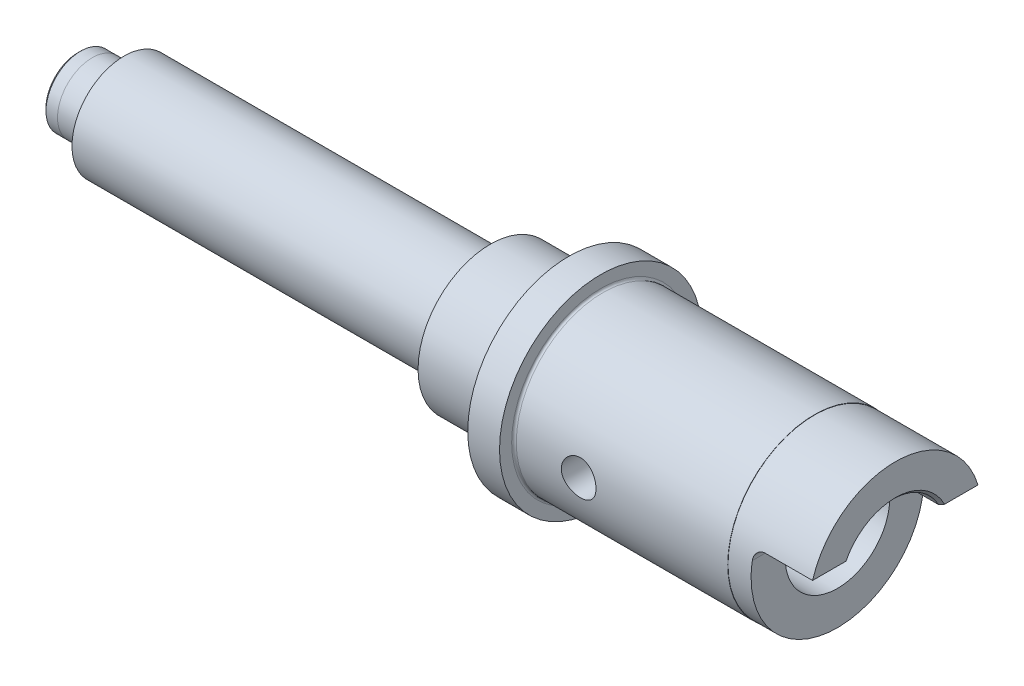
SolidWorks part; units mm, degrees
ref_plane "Face" through (0, 0, 0) normal (0, 0, 1) x (1, 0, 0)
ref_plane "Dessus" through (0, 0, 0) normal (0, 1, 0) x (1, 0, 0)
ref_plane "Droite" through (0, 0, 0) normal (1, 0, 0) x (0, 0, -1)
sketch "Esquisse1" plane through (0, 0, 0) normal (0, 0, 1) x (1, 0, 0)
  line L0 (-32.8532, 0) -> (158.3561, 0) construction
  line L1 (0, 0) -> (0, 5.495)
  line L2 (2.5, 6) -> (8, 6)
  line L3 (8, 6) -> (8, 9)
  line L4 (8, 9) -> (71.4, 9)
  line L5 (71.4, 9) -> (71.4, 12.5)
  line L6 (71.4, 12.5) -> (85, 12.5)
  line L7 (85, 12.5) -> (85, 17.5)
  line L8 (85, 17.5) -> (90.5, 17.5)
  line L9 (90.5, 17.5) -> (90.5, 15)
  line L10 (90.5, 15) -> (127.5, 15)
  line L11 (127.5, 15) -> (127.5, 14.95)
  line L12 (141.5, 0) -> (0, 0)
  line L13 (127.5, 14.95) -> (141.5, 14.95)
  line L14 (141.5, 14.95) -> (141.5, 0)
  line L15 (0, 5.495) -> (0.5, 5.995)
  line L16 (0.5, 5.995) -> (2.5, 6)
  dimension "D1" = 12
  dimension "D3" = 18
  dimension "D4" = 63.4
  dimension "D5" = 25
  dimension "D6" = 35
  dimension "D7" = 5.5
  dimension "D8" = 82.5
  dimension "D9" = 30
  dimension "D10" = 37
  dimension "D11" = 29.9
  dimension "D12" = 14
  dimension "D13" = 11.99
  dimension "D14" = 2
  dimension "D15" = 0.5
  dimension "D16" = 45
revolve "Révolution1" add sketch "Esquisse1" angle 360 about L0
hole_wizard "Diamètre du perçage Ø18.0 (18)1" positions "Esquisse3" profile "Esquisse2" hole size "Ø18.0" standard "ISO"
sketch "Esquisse3" plane through (141.5, 0, 0) normal (1, 0, 0) x (0, 0, -1)
  circle A0 centre (0, 0) radius 14.95 construction
  point P0 (0, 0)
sketch "Esquisse2" plane through (141.5, 0, 0) normal (0, 1, 0) x (0, 0, -1)
  line L0 (0, 0) -> (0, 47.4378)
  line L1 (0, 47.4378) -> (9.05, 42)
  line L2 (9.05, 42) -> (9.05, 0)
  line L5 (9.05, 0) -> (0, 0)
  line L10 (0, 47.4378) -> (-9.05, 42) construction
  line L11 (0, -6.35) -> (0, 107.95) construction
  dimension "Diamètre du perçage" = 18.1
  dimension "Profondeur du perçage" = 42
  dimension "Angle de pointe" = 118
sketch "Esquisse4" plane through (0, 0, 0) normal (0, 0, 1) x (1, 0, 0)
  line L0 (90.5, -15) -> (90.5, 15) construction
  line L1 (131.5, 4.3) -> (146.5, 4.3)
  line L2 (131.5, 4.3) -> (131.5, -25.7)
  line L3 (131.5, -25.7) -> (146.5, -25.7)
  line L4 (146.5, 4.3) -> (146.5, -25.7)
  dimension "D1" = 4.3
  dimension "D2" = 41
  dimension "D3" = 15
  dimension "D4" = 30
extrude "Enlèv. mat.-Extru.1" cut sketch "Esquisse4" against normal through all and the other way through all
sketch "Esquisse5" plane through (0, 0, 0) normal (0, 0, 1) x (1, 0, 0)
  line L0 (90.5, -15) -> (90.5, 15) construction
  circle A0 centre (101.7, 0) radius 3
  dimension "D1" = 6
  dimension "D2" = 11.2
extrude "Enlèv. mat.-Extru.2" cut sketch "Esquisse5" against normal through all and the other way through all
fillet "Congé1" radius 0.8 1 edges at (8, 0, 6)
fillet "Congé2" radius 0.8 1 edges at (71.4, 0, 9)
fillet "Congé3" radius 0.2 1 edges at (85, 0, 12.5)
fillet "Congé4" radius 0.4 1 edges at (90.5, 0, 15)
fillet "Congé5" radius 1.8 1 edges at (131.5, 4.3, 11.1407)
fillet "Congé6" radius 1.8 1 edges at (131.5, 4.3, -11.1407)
chamfer "Chanfrein2" distance 0.5 angle 45 1 edges at (141.5, 9.05, 0)
